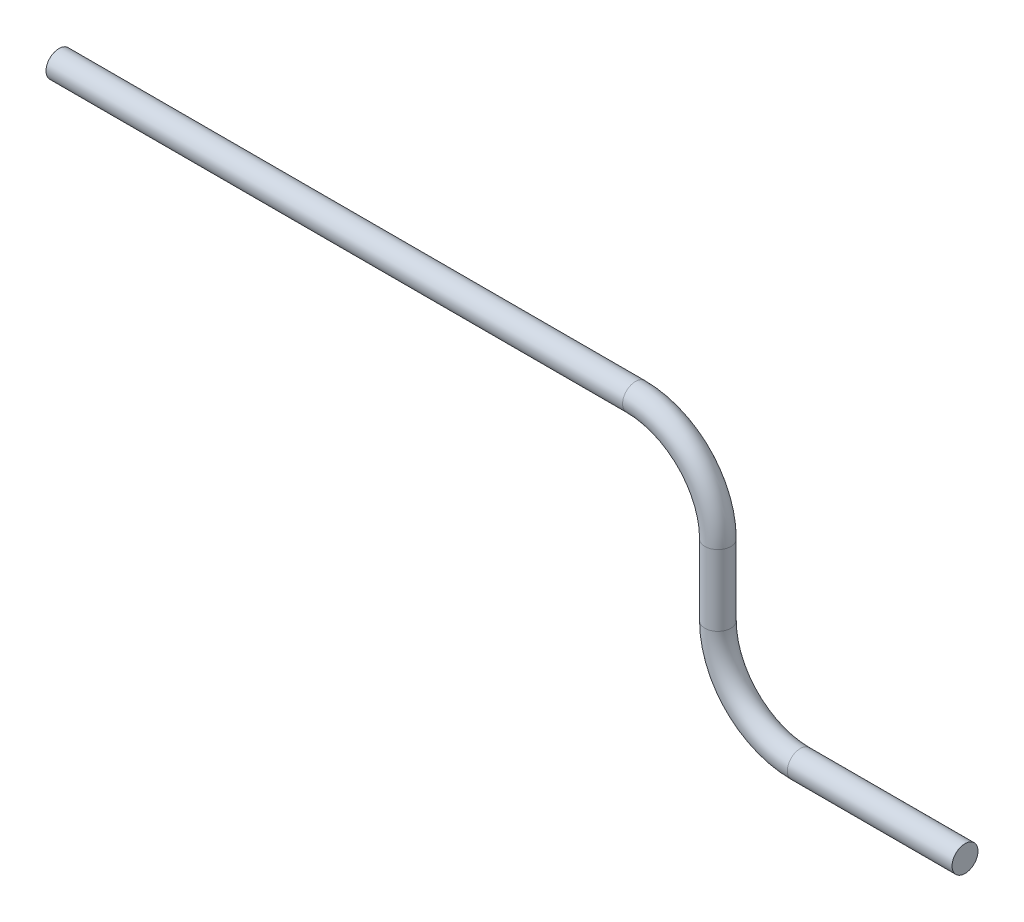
SolidWorks part; units mm, degrees
ref_plane "Front Plane" through (0, 0, 0) normal (0, 0, 1) x (1, 0, 0)
ref_plane "Top Plane" through (0, 0, 0) normal (0, 1, 0) x (1, 0, 0)
ref_plane "Right Plane" through (0, 0, 0) normal (1, 0, 0) x (0, 0, -1)
sketch "Sketch1" plane through (0, 0, 0) normal (0, 0, 1) x (1, 0, 0)
  line L0 (-80, 16.5915) -> (-10, 16.5915)
  line L1 (0, 6.5915) -> (0, -2.0053)
  line L2 (10, -12.0053) -> (30, -12.0053)
  arc A0 (-10, 16.5915) -> (0, 6.5915) centre (-10, 6.5915) cw
  arc A1 (0, -2.0053) -> (10, -12.0053) centre (10, -2.0053) ccw
  dimension "D1" = 10
  dimension "D2" = 70
  dimension "D3" = 20
sketch3d "3DSketch1"
  circle A0 centre (-80, 16.5915, 0) radius 1.575
  point P2 (-78.425, 16.5915, 0)
  dimension "D1" = 3.15
sweep "Sweep1" add profiles "3DSketch1" path "Sketch1"
sketch3d "3DSketch2" plane through (0, 0, 0) normal (0, 0, 1) x (1, 0, 0)
  dimension "D1" = 72.5
